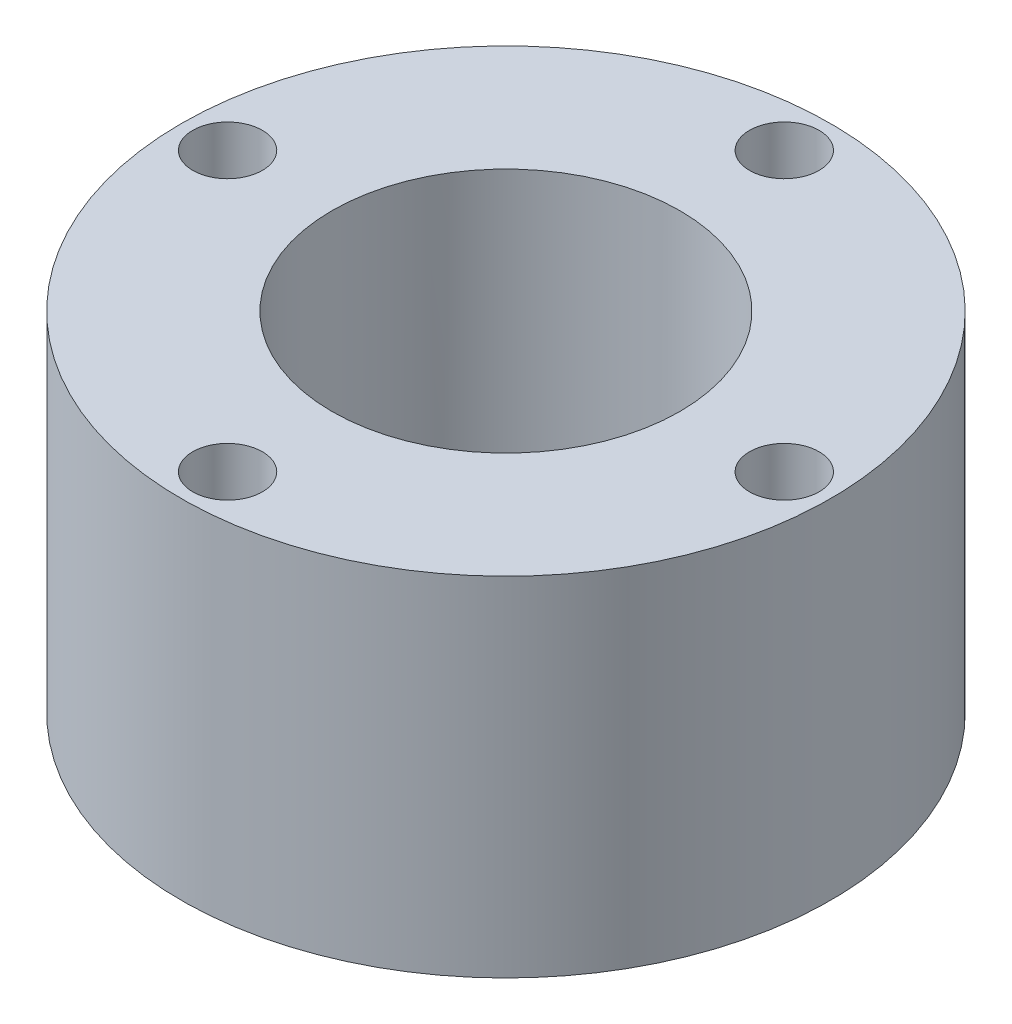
SolidWorks part; units mm, degrees
ref_plane "Front Plane" through (0, 0, 0) normal (0, 0, 1) x (1, 0, 0)
ref_plane "Top Plane" through (0, 0, 0) normal (0, 1, 0) x (1, 0, 0)
ref_plane "Right Plane" through (0, 0, 0) normal (1, 0, 0) x (0, 0, -1)
sketch "Sketch1" plane through (0, 0, 0) normal (0, 0, 1) x (1, 0, 0)
  line L0 (0, 0) -> (14, 0)
  line L1 (14, 0) -> (14, 120)
  line L2 (14, 120) -> (0, 120)
  line L3 (0, 120) -> (0, 0)
  dimension "D1" = 14
  dimension "D2" = 120
revolve "Revolve1" add sketch "Sketch1" angle 360 about L3
sketch "Sketch2" plane through (0, 0, 0) normal (0, -1, 0) x (1, 0, 0)
  circle A0 centre (0, 0) radius 7.5
  dimension "D1" = 15
extrude "Cut-Extrude1" cut sketch "Sketch2" against normal blind 15.8
sketch "Sketch4" plane through (0, 15.8, 0) normal (0, -1, 0) x (1, 0, 0)
  circle A0 centre (0, 0) radius 10
  dimension "D1" = 20
extrude "Cut-Extrude2" cut sketch "Sketch4" against normal blind 9
sketch "Sketch5" plane through (0, 120, 0) normal (0, 1, 0) x (1, 0, 0)
  circle A0 centre (0, 0) radius 14
extrude "Cut-Extrude3" cut sketch "Sketch5" against normal blind 105
sketch "Sketch6" plane through (0, 15, 0) normal (0, 1, 0) x (1, 0, 0)
  circle A0 centre (0, 12) radius 1.5
  circle A1 centre (12, 0) radius 1.5
  circle A2 centre (0, -12) radius 1.5
  circle A3 centre (-12, 0) radius 1.5
  point P12 (0, 0)
  dimension "D1" = 3
  dimension "D2" = 12
  dimension "D3" = 4
extrude "Cut-Extrude4" cut sketch "Sketch6" against normal blind 3.5
